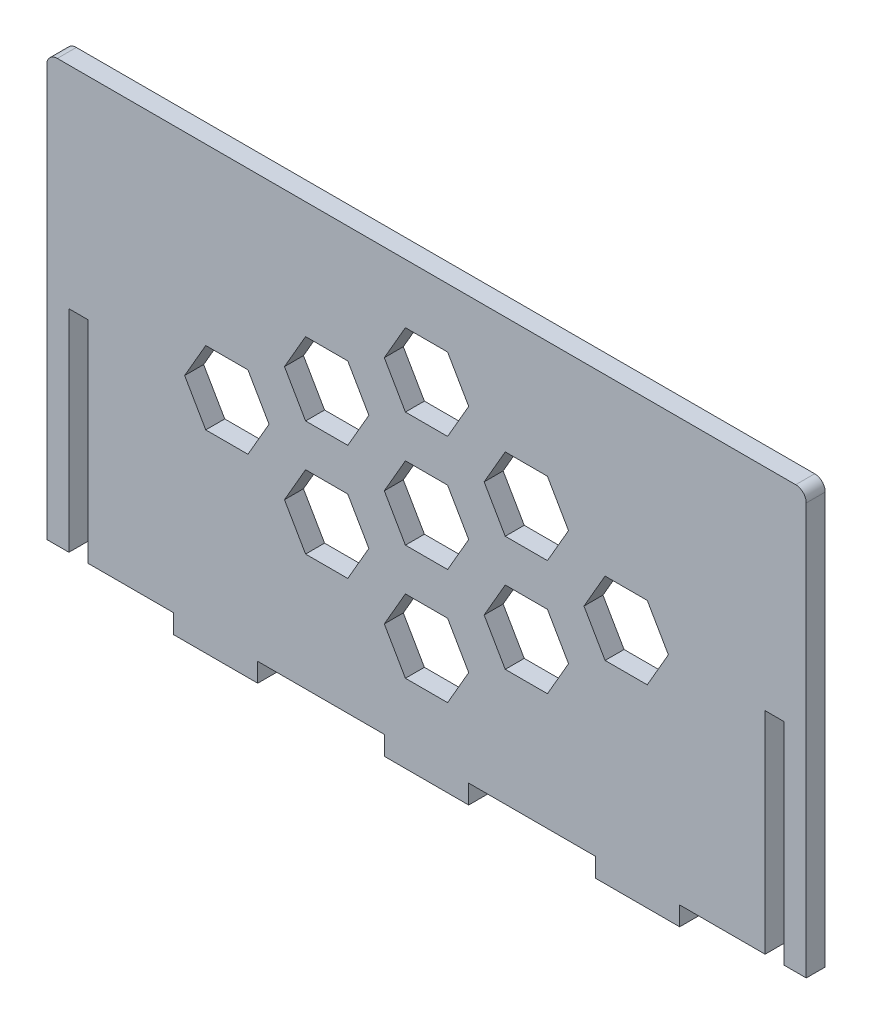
SolidWorks part; units mm, degrees
ref_plane "Piano frontale" through (0, 0, 0) normal (0, 0, 1) x (1, 0, 0)
ref_plane "Piano superiore" through (0, 0, 0) normal (0, 1, 0) x (1, 0, 0)
ref_plane "Piano destro" through (0, 0, 0) normal (1, 0, 0) x (0, 0, -1)
sketch "Schizzo1" plane through (0, 0, 0) normal (0, 0, 1) x (1, 0, 0)
  line L1 (-360, 200) -> (360, 200)
  line L2 (-360, 200) -> (-360, -200)
  line L3 (-360, -200) -> (360, -200)
  line L4 (360, 200) -> (360, -200)
  line L5 (-360, 200) -> (360, -200) construction
  line L6 (-360, -200) -> (360, 200) construction
  point P0 (0, 0)
  dimension "D1" = 720
  dimension "D2" = 400
extrude "Estrusione-Estrusione1" add sketch "Schizzo1" along normal blind 18
sketch "Schizzo2" plane through (0, 0, 18) normal (0, 0, 1) x (1, 0, 0)
  line L0 (-360, -209) -> (360, -209) construction
  line L1 (-360, 200) -> (-360, -200) construction
  line L2 (360, -200) -> (360, 200) construction
  line L3 (-360, -200) -> (360, -200) construction
  line L4 (0, 0) -> (0, 200) construction
  line L5 (-40, -218) -> (40, -218)
  line L6 (-40, -218) -> (-40, -200)
  line L7 (-40, -200) -> (40, -200)
  line L8 (40, -218) -> (40, -200)
  line L9 (-40, -218) -> (40, -200) construction
  line L10 (-40, -200) -> (40, -218) construction
  line L11 (-240, -218) -> (-160, -218)
  line L12 (-240, -218) -> (-240, -200)
  line L13 (-240, -200) -> (-160, -200)
  line L14 (-160, -218) -> (-160, -200)
  line L15 (-240, -218) -> (-160, -200) construction
  line L16 (-240, -200) -> (-160, -218) construction
  line L17 (360, 200) -> (-360, 200) construction
  line L18 (240, -200) -> (160, -218) construction
  line L19 (240, -218) -> (160, -200) construction
  line L20 (160, -218) -> (160, -200)
  line L21 (240, -200) -> (160, -200)
  line L22 (240, -218) -> (240, -200)
  line L23 (240, -218) -> (160, -218)
  point P2 (-200, -209)
  point P10 (0, -209)
  point P27 (200, -209)
  dimension "D1" = 9
  dimension "D2" = 80
  dimension "D3" = 200
extrude "Estrusione-Estrusione2" add sketch "Schizzo2" against normal blind 18
sketch "Schizzo4" plane through (0, 0, 18) normal (0, 0, 1) x (1, 0, 0)
  line L0 (-360, -200) -> (-240, -200) construction
  line L1 (-339, -200) -> (-321, -200)
  line L2 (-339, -200) -> (-339, 0)
  line L3 (-339, 0) -> (-321, 0)
  line L4 (-321, -200) -> (-321, 0)
  line L6 (0, 200) -> (0, -218) construction
  line L7 (360, 200) -> (-360, 200) construction
  line L8 (-40, -218) -> (40, -218) construction
  line L9 (321, -200) -> (321, 0)
  line L10 (339, 0) -> (321, 0)
  line L11 (339, -200) -> (339, 0)
  line L12 (339, -200) -> (321, -200)
  line L13 (-360, 200) -> (-360, -200) construction
  point P6 (-330, -200)
  dimension "D1" = 18
  dimension "D2" = 200
  dimension "D3" = 30
extrude "Taglio-Estrusione1" cut sketch "Schizzo4" against normal blind 18
fillet "Raccordo1" radius 10 2 edges at (360, 200, 9) (-360, 200, 9)
sketch "Schizzo5" plane through (0, 0, 18) normal (0, 0, 1) x (1, 0, 0)
  line L0 (40, 0) -> (263.6059, 0) construction
  line L1 (40, 0) -> (20, 34.641)
  line L2 (20, 34.641) -> (-20, 34.641)
  line L3 (-20, 34.641) -> (-40, 0)
  line L4 (-40, 0) -> (-20, -34.641)
  line L5 (-20, -34.641) -> (20, -34.641)
  line L6 (20, -34.641) -> (40, 0)
  line L7 (74.641, 20) -> (114.641, 20)
  line L8 (114.641, 20) -> (134.641, 54.641)
  line L9 (134.641, 54.641) -> (114.641, 89.282)
  line L10 (114.641, 89.282) -> (74.641, 89.282)
  line L11 (74.641, 89.282) -> (54.641, 54.641)
  line L12 (54.641, 54.641) -> (74.641, 20)
  line L13 (54.641, -54.641) -> (74.641, -20)
  line L14 (74.641, -89.282) -> (54.641, -54.641)
  line L15 (114.641, -89.282) -> (74.641, -89.282)
  line L16 (134.641, -54.641) -> (114.641, -89.282)
  line L17 (114.641, -20) -> (134.641, -54.641)
  line L18 (74.641, -20) -> (114.641, -20)
  line L19 (54.641, -54.641) -> (-135.9601, -54.641) construction
  line L20 (54.641, 54.641) -> (-105.6384, 54.641) construction
  line L21 (20, 143.923) -> (40, 109.282)
  line L22 (-20, 143.923) -> (20, 143.923)
  line L23 (-40, 109.282) -> (-20, 143.923)
  line L24 (-20, 74.641) -> (-40, 109.282)
  line L25 (20, 74.641) -> (-20, 74.641)
  line L26 (40, 109.282) -> (20, 74.641)
  line L27 (20, -74.641) -> (40, -109.282)
  line L28 (-20, -74.641) -> (20, -74.641)
  line L29 (-40, -109.282) -> (-20, -74.641)
  line L30 (-20, -143.923) -> (-40, -109.282)
  line L31 (20, -143.923) -> (-20, -143.923)
  line L32 (40, -109.282) -> (20, -143.923)
  line L33 (0, 143.923) -> (0, -143.923) construction
  line L34 (-74.641, -20) -> (-114.641, -20)
  line L35 (-114.641, -20) -> (-134.641, -54.641)
  line L36 (-134.641, -54.641) -> (-114.641, -89.282)
  line L37 (-114.641, -89.282) -> (-74.641, -89.282)
  line L38 (-74.641, -89.282) -> (-54.641, -54.641)
  line L39 (-54.641, -54.641) -> (-74.641, -20)
  line L40 (-54.641, 54.641) -> (-74.641, 20)
  line L41 (-74.641, 89.282) -> (-54.641, 54.641)
  line L42 (-114.641, 89.282) -> (-74.641, 89.282)
  line L43 (-134.641, 54.641) -> (-114.641, 89.282)
  line L44 (-114.641, 20) -> (-134.641, 54.641)
  line L45 (-74.641, 20) -> (-114.641, 20)
  line L46 (-94.641, 89.282) -> (-94.641, -89.282) construction
  line L47 (-209.282, -34.641) -> (-229.282, 0)
  line L48 (-169.282, -34.641) -> (-209.282, -34.641)
  line L49 (-149.282, 0) -> (-169.282, -34.641)
  line L50 (-169.282, 34.641) -> (-149.282, 0)
  line L51 (-209.282, 34.641) -> (-169.282, 34.641)
  line L52 (-229.282, 0) -> (-209.282, 34.641)
  line L53 (94.641, 89.282) -> (94.641, -89.282) construction
  line L54 (169.282, -34.641) -> (149.282, 0)
  line L55 (209.282, -34.641) -> (169.282, -34.641)
  line L56 (229.282, 0) -> (209.282, -34.641)
  line L57 (209.282, 34.641) -> (229.282, 0)
  line L58 (169.282, 34.641) -> (209.282, 34.641)
  line L59 (149.282, 0) -> (169.282, 34.641)
  circle A0 centre (0, 0) radius 34.641 construction
  circle A1 centre (94.641, 54.641) radius 34.641 construction
  circle A2 centre (94.641, -54.641) radius 34.641 construction
  circle A3 centre (0, 109.282) radius 34.641 construction
  circle A4 centre (0, -109.282) radius 34.641 construction
  circle A5 centre (-94.641, -54.641) radius 34.641 construction
  circle A6 centre (-94.641, 54.641) radius 34.641 construction
  circle A7 centre (-189.282, 0) radius 34.641 construction
  circle A8 centre (189.282, 0) radius 34.641 construction
  point P74 (89.9645, -86.582)
  dimension "D1" = 40
  dimension "D2" = 20
  dimension "D3" = 40
extrude "Taglio-Estrusione2" cut sketch "Schizzo5" against normal blind 18
